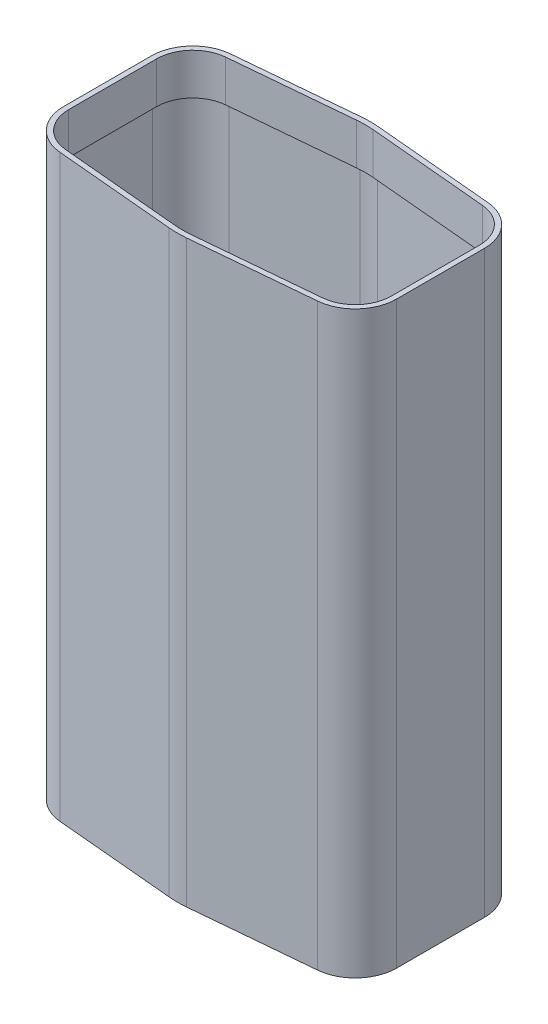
SolidWorks part; units mm, degrees
ref_plane "Front Plane" through (0, 0, 0) normal (0, 0, 1) x (1, 0, 0)
ref_plane "Top Plane" through (0, 0, 0) normal (0, 1, 0) x (1, 0, 0)
ref_plane "Right Plane" through (0, 0, 0) normal (1, 0, 0) x (0, 0, -1)
sketch "Sketch1" plane through (0, 0, 0) normal (0, 1, 0) x (1, 0, 0)
  line L0 (-198.1243, 53.975) -> (-198.1243, -53.975)
  line L1 (-157.687, 98.2435) -> (-10.1178, 111.6199)
  line L2 (-157.687, -98.2435) -> (-10.1178, -111.6199)
  line L3 (10.1178, 111.6199) -> (157.687, 98.2435)
  line L4 (10.1178, -111.6199) -> (157.687, -98.2435)
  line L5 (-204.4743, 53.975) -> (-204.4743, -53.975)
  line L6 (-158.2602, -104.5676) -> (-10.691, -117.944)
  line L7 (10.691, -117.944) -> (158.2602, -104.5676)
  line L8 (204.4743, -53.975) -> (204.4743, 53.975)
  line L9 (10.691, 117.944) -> (158.2602, 104.5676)
  line L10 (-158.2602, 104.5676) -> (-10.691, 117.944)
  line L14 (198.1243, -53.975) -> (198.1243, 53.975)
  arc A0 (-198.1243, -53.975) -> (-157.687, -98.2435) centre (-153.6743, -53.975) ccw
  arc A1 (-157.687, 98.2435) -> (-198.1243, 53.975) centre (-153.6743, 53.975) ccw
  arc A3 (-10.1178, 111.6199) -> (10.1178, 111.6199) centre (0, 0) cw
  arc A4 (-10.1178, -111.6199) -> (10.1178, -111.6199) centre (0, 0) ccw
  circle A6 centre (0, 0) radius 104.4829 construction
  circle A7 centre (0, 0) radius 103.3093 construction
  circle A8 centre (0, 0) radius 109.5375 construction
  arc A11 (-204.4743, -53.975) -> (-158.2602, -104.5676) centre (-153.6743, -53.975) ccw
  arc A12 (-10.691, -117.944) -> (10.691, -117.944) centre (0, 0) ccw
  arc A13 (157.687, -98.2435) -> (198.1243, -53.975) centre (153.6743, -53.975) ccw
  arc A14 (157.687, 98.2435) -> (198.1243, 53.975) centre (153.6743, 53.975) cw
  arc A17 (158.2602, -104.5676) -> (204.4743, -53.975) centre (153.6743, -53.975) ccw
  arc A18 (158.2602, 104.5676) -> (204.4743, 53.975) centre (153.6743, 53.975) cw
  arc A19 (-10.691, 117.944) -> (10.691, 117.944) centre (0, 0) cw
  arc A20 (-158.2602, 104.5676) -> (-204.4743, 53.975) centre (-153.6743, 53.975) ccw
  circle A21 centre (-153.6743, 53.975) radius 44.45 construction
  circle A22 centre (-153.6743, -53.975) radius 44.45 construction
  circle A23 centre (153.6743, 53.975) radius 44.45 construction
  circle A24 centre (153.6743, -53.975) radius 44.45 construction
  dimension "D1" = 2.54
  dimension "D2" = 2.54
  dimension "D3" = 6.35
extrude "Boss-Extrude1" add sketch "Sketch1" along normal blind 711.2
ref_plane "Plane1" through (0, 25.4, 0) normal (0, 1, 0) x (1, 0, 0)
sketch "Sketch2" plane through (0, 25.4, 0) normal (0, 1, 0) x (1, 0, 0)
  line L42 (-202.8868, 53.975) -> (-202.8868, -53.975)
  line L43 (-158.1169, -102.9866) -> (-10.5477, -116.3629)
  line L44 (10.5477, -116.3629) -> (158.1169, -102.9866)
  line L45 (202.8868, -53.975) -> (202.8868, 53.975)
  line L46 (158.1169, 102.9866) -> (10.5477, 116.3629)
  line L47 (-10.5477, 116.3629) -> (-158.1169, 102.9866)
  line L48 (-202.8868, 53.975) -> (-202.8868, -53.975)
  line L49 (-158.1169, -102.9866) -> (-10.5477, -116.3629)
  line L50 (10.5477, -116.3629) -> (158.1169, -102.9866)
  line L51 (202.8868, -53.975) -> (202.8868, 53.975)
  line L52 (158.1169, 102.9866) -> (10.5477, 116.3629)
  line L53 (-10.5477, 116.3629) -> (-158.1169, 102.9866)
  arc A48 (-202.8868, -53.975) -> (-158.1169, -102.9866) centre (-153.6743, -53.975) ccw
  arc A49 (-10.5477, -116.3629) -> (10.5477, -116.3629) centre (0, 0) ccw
  arc A50 (158.1169, -102.9866) -> (202.8868, -53.975) centre (153.6743, -53.975) ccw
  arc A51 (202.8868, 53.975) -> (158.1169, 102.9866) centre (153.6743, 53.975) ccw
  arc A52 (10.5477, 116.3629) -> (-10.5477, 116.3629) centre (0, 0) ccw
  arc A53 (-158.1169, 102.9866) -> (-202.8868, 53.975) centre (-153.6743, 53.975) ccw
  arc A54 (-202.8868, -53.975) -> (-158.1169, -102.9866) centre (-153.6743, -53.975) ccw
  arc A55 (-10.5477, -116.3629) -> (10.5477, -116.3629) centre (0, 0) ccw
  arc A56 (158.1169, -102.9866) -> (202.8868, -53.975) centre (153.6743, -53.975) ccw
  arc A57 (202.8868, 53.975) -> (158.1169, 102.9866) centre (153.6743, 53.975) ccw
  arc A58 (10.5477, 116.3629) -> (-10.5477, 116.3629) centre (0, 0) ccw
  arc A59 (-158.1169, 102.9866) -> (-202.8868, 53.975) centre (-153.6743, 53.975) ccw
  dimension "D1" = 4.7625
extrude "Cut-Extrude1" cut sketch "Sketch2" along normal blind 186.2667
pattern_linear "LPattern1" count 3 spacing 224.3667 along (0, 1, 0) of "Cut-Extrude1"
